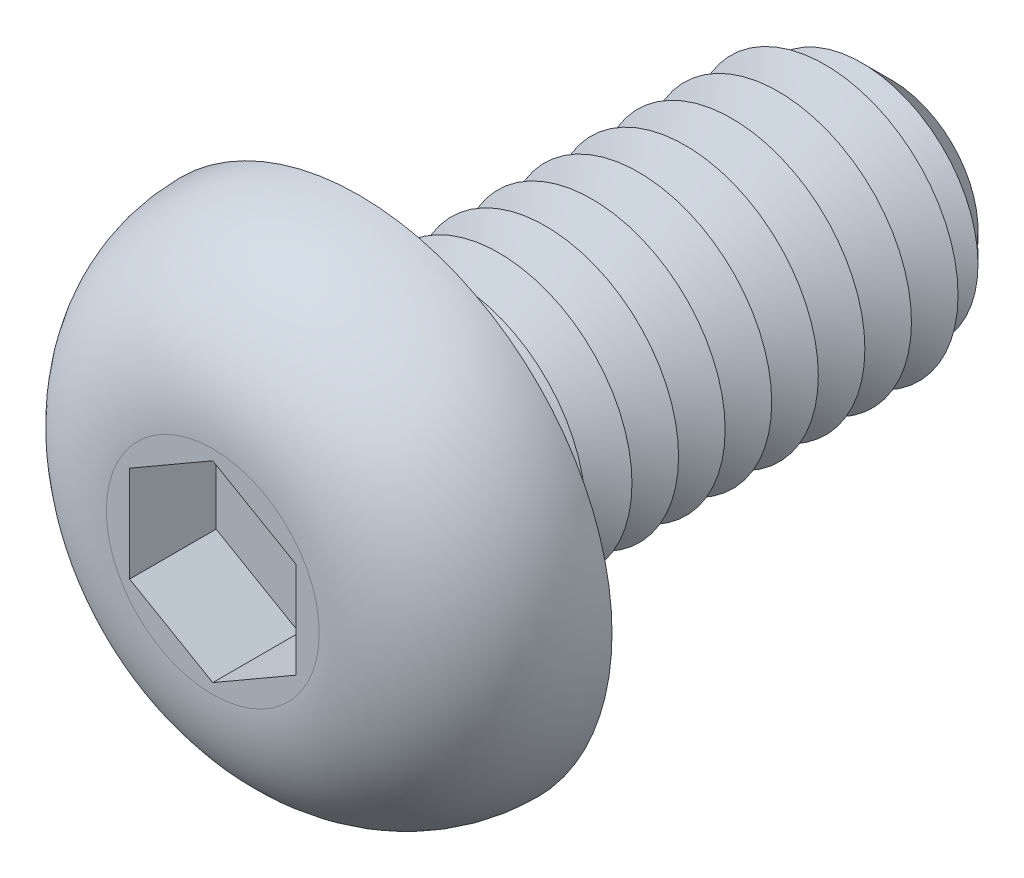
SolidWorks part; units mm, degrees
ref_plane "Front Plane" through (0, 0, 0) normal (0, 0, 1) x (1, 0, 0)
ref_plane "Top Plane" through (0, 0, 0) normal (0, 1, 0) x (1, 0, 0)
ref_plane "Right Plane" through (0, 0, 0) normal (1, 0, 0) x (0, 0, -1)
sketch "Sketch1" plane through (0, 0, 0) normal (1, 0, 0) x (0, 0, -1)
  line L0 (-47.9342, 0) -> (60.3146, 0) construction
sketch "Sketch2" plane through (0, 0, 0) normal (1, 0, 0) x (0, 0, -1)
  line L0 (0, 0) -> (-2.2, 0)
  line L1 (-47.9342, 0) -> (60.3146, 0) construction
  line L2 (-2.2, 0) -> (-2.2, 1.6)
  line L3 (0, 3.8) -> (0, 0)
  arc A0 (-2.2, 1.6) -> (0, 3.8) centre (0, 1.6) cw
  dimension "D1" = 2.2
  dimension "D2" = 2.2
  dimension "D3" = 3.8
revolve "Revolve1" add sketch "Sketch2" angle 360 about L0
sketch "Sketch3" plane through (0, 0, 2.2) normal (0, 0, 1) x (1, 0, 0)
  line L1 (0, 1.4434) -> (-1.25, 0.7217)
  line L2 (-1.25, 0.7217) -> (-1.25, -0.7217)
  line L3 (-1.25, -0.7217) -> (0, -1.4434)
  line L4 (0, -1.4434) -> (1.25, -0.7217)
  line L5 (1.25, -0.7217) -> (1.25, 0.7217)
  line L6 (1.25, 0.7217) -> (0, 1.4434)
  circle A0 centre (0, 0) radius 1.25 construction
  dimension "D1" = 2.5
extrude "Cut-Extrude1" cut sketch "Sketch3" against normal blind 1.3
sketch "Sketch4" plane through (0, 0, 0) normal (0, 0, -1) x (-1, 0, 0)
  circle A0 centre (0, 0) radius 2
  dimension "D1" = 4
extrude "Boss-Extrude1" add sketch "Sketch4" along normal blind 8
chamfer "Chamfer1" distance 0.7 angle 45 1 edges at (-2, 0, -8)
sketch "Sketch5" plane through (0, 0, 0) normal (1, 0, 0) x (0, 0, -1)
  line L0 (0.7, 2) -> (1.4, 2)
  line L1 (7.3, 2) -> (0, 2) construction
  line L2 (1.4, 2) -> (1.05, 1.3938)
  line L3 (1.05, 1.3938) -> (0.7, 2)
  line L4 (0, -3.8) -> (0, 3.8) construction
  line L5 (7.3, 2) -> (0, 2) construction
  dimension "D1" = 0.7
  dimension "D2" = 0.7
revolve "Cut-Revolve1" cut sketch "Sketch5" angle 360 about L0
pattern_linear "LPattern1" count 10 spacing 0.7 along (0, 0, -1) of "Cut-Revolve1"
fillet "Fillet2" radius 0.35 1 edges at (2, 0, 0)
sketch "Sketch6" plane through (0, 0, 0.9) normal (0, 0, 1) x (1, 0, 0)
  circle A0 centre (0, 0) radius 0.5
  dimension "D1" = 1
extrude "Cut-Extrude2" cut sketch "Sketch6" against normal up to surface (8.9 mm away)
